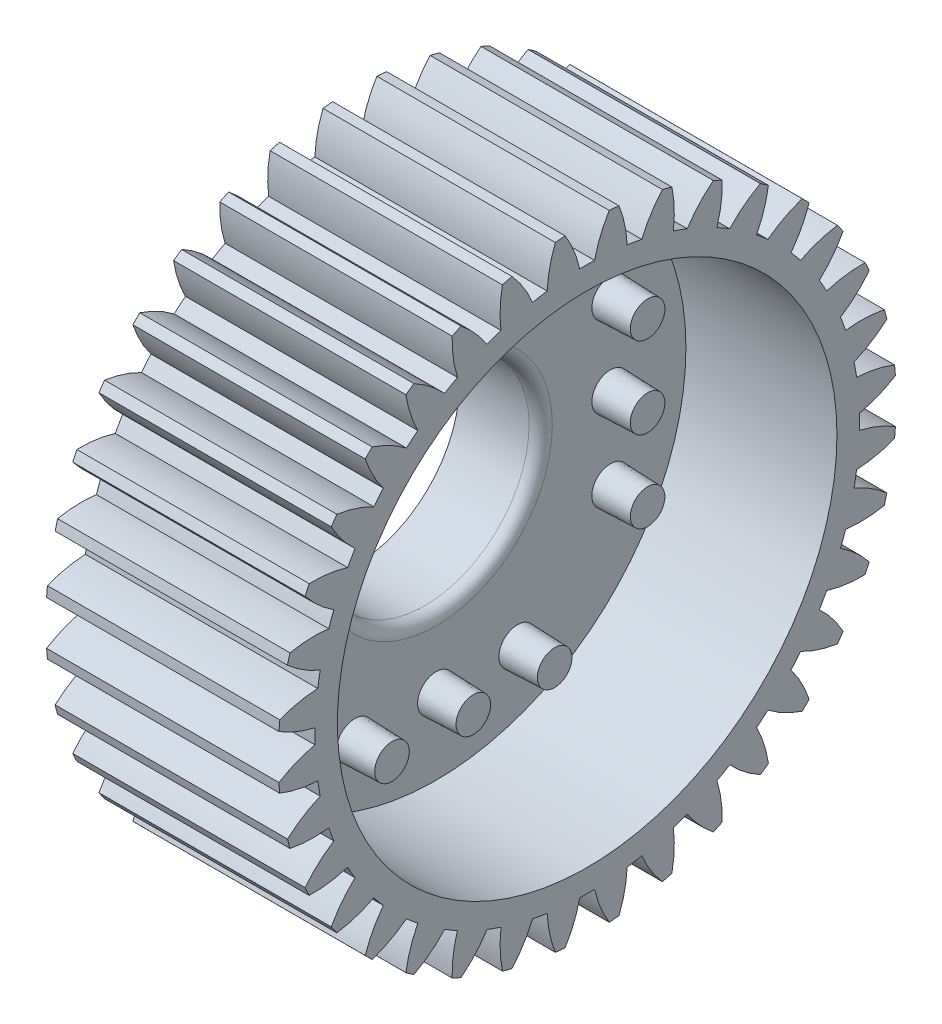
SolidWorks part; units mm, degrees
ref_plane "Plane1" through (0, 0, 0) normal (0, 0, 1) x (1, 0, 0)
ref_plane "Plane2" through (0, 0, 0) normal (0, 1, 0) x (1, 0, 0)
ref_plane "Plane3" through (0, 0, 0) normal (1, 0, 0) x (0, 0, -1)
sketch "HoldingSke" plane through (0, 0, 0) normal (0, 1, 0) x (1, 0, 0)
  line L0 (0, 0) -> (1.1557, -0.8397)
  line L1 (-15, 0) -> (100, 0) construction
  line L2 (0, 0) -> (-2.1039, 2.3779)
  line L3 (0, 0) -> (-11.863, 4.5341)
  line L4 (0, 0) -> (6.9867, 5.0761)
  line L5 (0, 0) -> (-46.8476, -17.4728)
  line L6 (0, 0) -> (-8.2896, -5.593)
  line L7 (-2.1039, 2.3779) -> (8.6586, 51.2059)
  line L8 (-76.2, 54.61) -> (-72.9, 54.61)
  line L9 (-71.009, 38.7566) -> (-53.1078, 45.2721)
  line L10 (-76.2, 71.12) -> (104.1128, 71.12)
  line L11 (0, 0) -> (-10, 0)
  line L12 (-76.2, 101.6) -> (-76.173, 101.6)
  line L13 (24.9733, 27.94) -> (52.9518, 28.4284)
  line L14 (24.9733, 27.94) -> (24.9743, 27.94)
  line L15 (24.9733, 27.94) -> (100.4006, 29.5858)
  line L16 (-63.627, -0.7) -> (-12.827, -0.7)
  circle A0 centre (0, 0) radius 11
  circle A1 centre (0, 0) radius 11.724
  circle A2 centre (0, 0) radius 37.5
  circle A3 centre (0, 0) radius 11
  dimension "MHD" = 23.448
  dimension "Hub_dia" = 75
  dimension "Bore" = 22
  dimension "MBD" = 22
  dimension "Num_teeth" = 36
  dimension "Pitch_radius" = 180.3128
  dimension "Pitch" = 1.4286
  dimension "Width" = 10
  dimension "Overall_len" = 50
  dimension "Show_teeth" = 36
  dimension "Thickness" = 10
  dimension "OAL" = 50.0001
  dimension "T_dim" = 3.3
  dimension "Ap" = 20
  dimension "H" = 19.05
  dimension "Backlash" = 0.027
  dimension "Addendum_fac" = 1
  dimension "Dedendum_fac" = 1.25
  dimension "Clearance_fac" = 0.25
  dimension "Dedendum_add" = 0.001
  dimension "Module" = 0.7
sketch "BasProSke" plane through (0, 0, 0) normal (0, 1, 0) x (1, 0, 0)
  line L0 (-10, 0) -> (60, 0) construction
  line L1 (0, 0) -> (0, 13.3)
  line L2 (0, 0) -> (10, 0)
  line L3 (10, 0) -> (10, 13.3)
  line L4 (10, 13.3) -> (0, 13.3)
  dimension "Diameter" = 26.6
  dimension "Thickness" = 10
revolve "Base-Revolve" add sketch "BasProSke" angle 360 about L0
sketch "TooCutSke" plane through (0, 0, 0) normal (1, 0, 0) x (0, 0, -1)
  line L1 (0, 0) -> (0, 107) construction
  line L2 (0, 0) -> (-0.5968, 12.5859) construction
  line L3 (0, 0) -> (-2.1946, 25.0841) construction
  line L4 (-0.5968, 12.5859) -> (-1.0973, 12.5421) construction
  arc A0 (0.3189, 11.7197) -> (-0.3189, 11.7197) centre (0, 0) ccw
  arc A1 (0.9635, 13.2905) -> (-0.9635, 13.2905) centre (0, 0) ccw
  circle A2 centre (0, 0) radius 12.6 construction
  circle A3 centre (0, 0) radius 11.8401 construction
  arc A4 (-0.3189, 11.7197) -> (-0.9635, 13.2905) centre (-5.2372, 10.6189) ccw
  arc A5 (0.9635, 13.2905) -> (0.3189, 11.7197) centre (5.2372, 10.6189) ccw
  dimension "Root_dia" = 23.448
  dimension "Overcut_dia" = 26.6508
  dimension "Pitch_dia" = 25.2
  dimension "Base_dia" = 23.6803
  dimension "Flank_rad" = 5.04
  dimension "Half_ang" = 5
  dimension "Half_CT" = 0.5024
extrude "ToothCut" cut sketch "TooCutSke" along normal through all
fillet "Breaks" [suppressed] radius 0.014
fillet "RootFillets" [suppressed] radius 0.176
pattern_circular "TeethCuts" count 36 over 360 about axis through (0, 0, 0) along (1, 0, 0) of "ToothCut", "RootFillets", "Breaks"
sketch "HubNeaOneSke" plane through (0, 0, 0) normal (-1, 0, 0) x (0, 0, 1)
  circle A0 centre (0, 0) radius 11.724
  dimension "Diameter" = 23.448
extrude "HubNearOne" [suppressed] add sketch "HubNeaOneSke" along normal blind 40.0001
sketch "HubNeaBotSke" plane through (0, 0, 0) normal (-1, 0, 0) x (0, 0, 1)
  circle A0 centre (0, 0) radius 11.724
  dimension "Diameter" = 23.448
extrude "HubNearBoth" [suppressed] add sketch "HubNeaBotSke" along normal blind 20
ref_plane "FarPln" through (10, 0, 0) normal (1, 0, 0) x (0, 0, -1)
sketch "HubFarSke" plane through (10, 0, 0) normal (1, 0, 0) x (0, 0, -1)
  circle A0 centre (0, 0) radius 11.724
  dimension "Diameter" = 23.448
extrude "HubFar" [suppressed] add sketch "HubFarSke" along normal blind 20
sketch "BorSke" plane through (0, 0, 0) normal (1, 0, 0) x (0, 0, -1)
  circle A0 centre (0, 0) radius 11
  dimension "Diameter" = 22
extrude "Bore" cut sketch "BorSke" along normal mid plane 100.0001
sketch "KeySke" plane through (0, 0, 0) normal (1, 0, 0) x (0, 0, -1)
  line L0 (-4, 0) -> (-4, 14.3)
  line L1 (-4, 14.3) -> (4, 14.3)
  line L2 (4, 14.3) -> (4, 0)
  line L3 (0, 0) -> (0, 34) construction
  line L4 (-4, 0) -> (4, 0)
  dimension "Offset" = 14.3
  dimension "Width" = 8
extrude "Keyway" [suppressed] cut sketch "KeySke" along normal mid plane 100.0001
pattern_circular "Keyway2" [suppressed] count 2 every 90 about axis through (-10, 0, 0) along (1, 0, 0)
sketch "Sketch1" plane through (0, 0, 0) normal (1, 0, 0) x (0, 0, -1)
  circle A0 centre (0, 0) radius 11
  circle A1 centre (0, 0) radius 4.5
extrude "Boss-Extrude1" add sketch "Sketch1" along normal blind 3.5
sketch "Sketch2" plane through (10, 0, 0) normal (1, 0, 0) x (0, 0, -1)
  circle A0 centre (0, 0) radius 11
  circle A1 centre (0, 0) radius 10.75
extrude "Boss-Extrude2" add sketch "Sketch2" against normal blind 10
sketch "Sketch3" plane through (3.5, 0, 0) normal (1, 0, 0) x (0, 0, -1)
  line L0 (0, 0) -> (0, 7.5) construction
  line L1 (0, 7.5) -> (-3.5, 7.5) construction
  line L2 (0, 0) -> (-5.9246, 5.9246) construction
  line L3 (0, 0) -> (-4.9028, 0) construction
  circle A0 centre (-3.5, 7.5) radius 0.8
  circle A1 centre (0, 7.5) radius 0.8
  circle A2 centre (3.5, 7.5) radius 0.8
  circle A3 centre (-7.5, -3.5) radius 0.8
  circle A4 centre (-7.5, 0) radius 0.8
  circle A5 centre (-7.5, 3.5) radius 0.8
  circle A6 centre (7.5, -3.5) radius 0.8
  circle A7 centre (7.5, 0) radius 0.8
  circle A8 centre (7.5, 3.5) radius 0.8
  circle A9 centre (3.5, -7.5) radius 0.8
  circle A10 centre (0, -7.5) radius 0.8
  circle A11 centre (-3.5, -7.5) radius 0.8
  dimension "D3" = 45
  dimension "D1" = 7.5
  dimension "D2" = 3.5
extrude "Boss-Extrude3" add sketch "Sketch3" along normal blind 1.6 draft 2
fillet "Fillet1" radius 0.5 1 edges at (3.5, 0, -4.5)
equation "' \"Module@HoldingSke\" = 6.35"
equation "' \"Num_teeth@HoldingSke\" = 12"
equation "' \"Ap@HoldingSke\" =  20"
equation "' \"Width@HoldingSke\" = 0.5 * 25.4"
equation "' \"Hub_dia@HoldingSke\"= 1 * 25.4"
equation "' \"Overall_len@HoldingSke\" = 1.0 * 25.4"
equation "' \"Bore@HoldingSke\" = 0.75 * 25.4"
equation "' \"T_dim@HoldingSke\" = 0.1 * 25.4"
equation "' \"Width@KeySke\" = 0.25 * 25.4"
equation "' \"Show_teeth@HoldingSke\" = 13"
equation "' \"Backlash@HoldingSke\" = 0.009 * 25.4"
equation "' \"Addendum_fac@HoldingSke\" = 1.0"
equation "' \"Dedendum_fac@HoldingSke\" = 1.25"
equation "' \"Dedendum_add@HoldingSke\" = 0.00005 * 25.4"
equation "' \"Clearance_fac@HoldingSke\" = 0.25"
equation "\"Pitch@HoldingSke\" = 1 / \"Module@HoldingSke\""
equation "\"Overcut_dia@TooCutSke\" = (\"Num_teeth@HoldingSke\" + 2 * \"Addendum_fac@HoldingSke\") / \"Pitch@HoldingSke\" + 0.002 * 25.4"
equation "\"Pitch_dia@TooCutSke\" = \"Num_teeth@HoldingSke\" / \"Pitch@HoldingSke\""
equation "\"Base_dia@TooCutSke\" = \"Num_teeth@HoldingSke\" / \"Pitch@HoldingSke\" * cos((\"Ap@HoldingSke\"  * 3.14159265 / 180))"
equation "\"Root_dia@TooCutSke\" = (\"Num_teeth@HoldingSke\" + 2) / \"Pitch@HoldingSke\" - 2 * (\"Addendum_fac@HoldingSke\" + \"Dedendum_fac@HoldingSke\") / \"Pitch@HoldingSke\" - \"Dedendum_add@HoldingSke\" * 2"
equation "\"Half_ang@TooCutSke\" = 180 / \"Num_teeth@HoldingSke\""
equation "\"Half_CT@TooCutSke\" = \"Num_teeth@HoldingSke\" / \"Pitch@HoldingSke\" * sin((3.14159265 / 2 / \"Num_teeth@HoldingSke\")) / 2 - 7 * \"Backlash@HoldingSke\" / 4"
equation "\"Flank_rad@TooCutSke\" = \"Num_teeth@HoldingSke\" / \"Pitch@HoldingSke\" / 5"
equation "\"Radius@RootFillets\" = \"Clearance_fac@HoldingSke\" / \"Pitch@HoldingSke\" + \"Dedendum_add@HoldingSke\""
equation "\"Break_rad@Breaks\" = 0.02 / \"Pitch@HoldingSke\""
equation "\"Thickness@HoldingSke\" = \"Width@HoldingSke\""
equation "\"OAL@HoldingSke\" = \"Thickness@HoldingSke\""
equation "\"MHD@HoldingSke\" = (\"Num_teeth@HoldingSke\" + 2) / \"Pitch@HoldingSke\" - 2 * (\"Addendum_fac@HoldingSke\" + \"Dedendum_fac@HoldingSke\")  / \"Pitch@HoldingSke\" - \"Dedendum_add@HoldingSke\" * 2"
equation "\"MBD@HoldingSke\" = (\"Num_teeth@HoldingSke\" + 2) / \"Pitch@HoldingSke\" - 2 * (\"Addendum_fac@HoldingSke\" + \"Dedendum_fac@HoldingSke\")  / \"Pitch@HoldingSke\" - \"Dedendum_add@HoldingSke\" * 2 - 0.002 * 25.4"
equation "\"MHD@HoldingSke\" = ((sgn( \"MHD@HoldingSke\" - \"Hub_dia@HoldingSke\" )-1)*( \"MHD@HoldingSke\" - \"Hub_dia@HoldingSke\" ))/-2+ \"Hub_dia@HoldingSke\""
equation "\"MBD@HoldingSke\" = ((sgn( \"MBD@HoldingSke\" - \"Bore@HoldingSke\" )-1)*( \"MBD@HoldingSke\" - \"Bore@HoldingSke\" ))/-2+ \"Bore@HoldingSke\""
equation "\"OAL@HoldingSke\" = ((sgn( \"OAL@HoldingSke\" - \"Overall_len@HoldingSke\" )+1)*( \"OAL@HoldingSke\" - \"Overall_len@HoldingSke\" ))/2 + \"Overall_len@HoldingSke\" + 0.000002 * 25.4"
equation "\"Num_teeth@TeethCuts\" = int( \"Show_teeth@HoldingSke\" ) + 1"
equation "\"Num_teeth@TeethCuts\" = ((sgn( \"Num_teeth@TeethCuts\" - \"Num_teeth@HoldingSke\" )-1)*( \"Num_teeth@TeethCuts\" - \"Num_teeth@HoldingSke\" ))/-2+ \"Num_teeth@HoldingSke\""
equation "\"Num_teeth@TeethCuts\" = ((sgn( \"Num_teeth@TeethCuts\" - 2.0)+1)*( \"Num_teeth@TeethCuts\" - 2.0))/2 +2.0"
equation "\"Angle@TeethCuts\" = 360.0 / \"Num_teeth@HoldingSke\""
equation "\"Diameter@BasProSke\" = (\"Num_teeth@HoldingSke\" + 2 * \"Addendum_fac@HoldingSke\") / \"Pitch@HoldingSke\""
equation "\"Thickness@BasProSke\"  = \"Thickness@HoldingSke\""
equation "' \"Fillet_rad@BasProSke\" =  \"Thickness@HoldingSke\" * 0.05"
equation "\"MHD@HoldingSke\" = ((sgn( \"MHD@HoldingSke\" - \"Root_dia@TooCutSke\" )-1)*( \"MHD@HoldingSke\" - \"Root_dia@TooCutSke\" ))/-2+ \"Root_dia@TooCutSke\""
equation "\"Diameter@HubNeaOneSke\" = \"MHD@HoldingSke\""
equation "\"Length@HubNearOne\" = \"OAL@HoldingSke\" - \"Thickness@BasProSke\""
equation "\"Diameter@HubNeaBotSke\" = \"MHD@HoldingSke\""
equation "\"Length@HubNearBoth\" = ( \"OAL@HoldingSke\" - \"Thickness@BasProSke\" ) / 2.0"
equation "\"Thickness@FarPln\" = \"Thickness@BasProSke\""
equation "\"Diameter@HubFarSke\" = \"MHD@HoldingSke\""
equation "\"Length@HubFar\" = ( \"OAL@HoldingSke\" - \"Thickness@BasProSke\" ) / 2.0"
equation "\"Diameter@BorSke\" = \"MBD@HoldingSke\""
equation "\"D1@Bore\" = \"OAL@HoldingSke\" * 2.0"
equation "\"D1@Keyway\" = \"OAL@HoldingSke\" * 2.0"
equation "\"Offset@KeySke\" = \"T_dim@HoldingSke\" + \"MBD@HoldingSke\" / 2.0"
